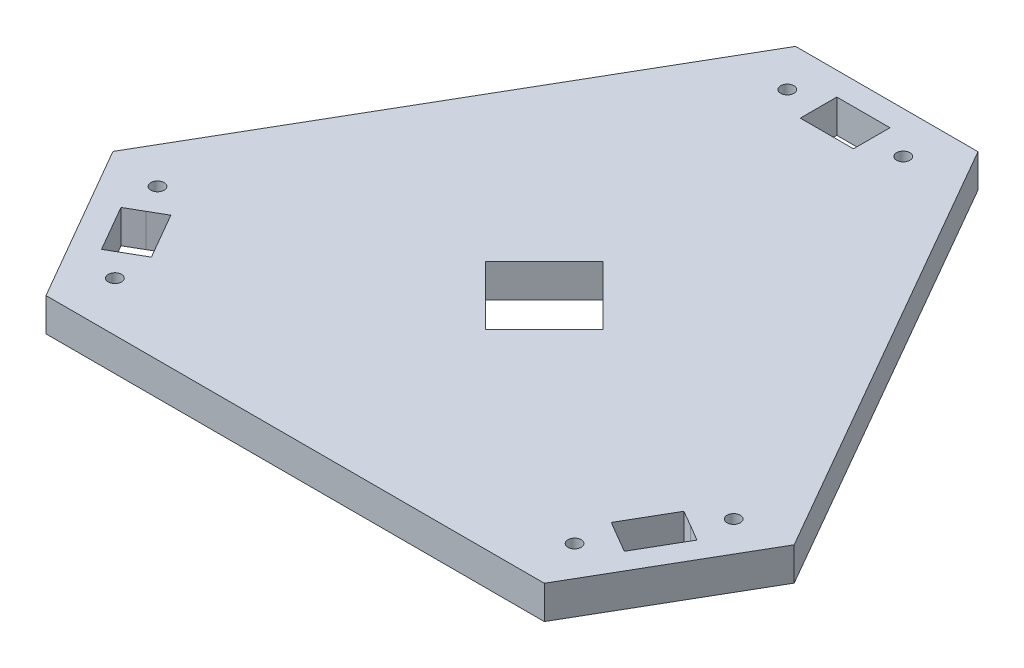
SolidWorks part; units mm, degrees
ref_plane "Ebene vorne" through (0, 0, 0) normal (0, 0, 1) x (1, 0, 0)
ref_plane "Ebene oben" through (0, 0, 0) normal (0, 1, 0) x (1, 0, 0)
ref_plane "Ebene rechts" through (0, 0, 0) normal (1, 0, 0) x (0, 0, -1)
sketch "Skizze1" plane through (0, 0, 0) normal (0, 1, 0) x (1, 0, 0)
  line L0 (-149.9886, 0) -> (150.0755, 0)
  line L1 (-54.2372, 355.613) -> (-204.9943, 95.3014)
  line L4 (205.2183, 95.3014) -> (55.5843, 355.613)
  line L5 (-54.2372, 355.613) -> (55.5843, 355.613)
  line L6 (205.2183, 95.3014) -> (150.0755, 0)
  line L7 (-149.9886, 0) -> (-204.9943, 95.3014)
extrude "Aufsatz-Linear austragen1" add sketch "Skizze1" along normal blind 20 contours L1 L7 L0 L6 L4 L5
sketch "Skizze2" plane through (0, 20, 0) normal (0, 1, 0) x (1, 0, 0)
  line L0 (205.2183, 95.3014) -> (150.0755, 0) construction
  circle A0 centre (173.5631, 90.5109) radius 4
  circle A1 centre (138.4531, 29.8315) radius 4
  dimension "D1" = 25
  dimension "D2" = 25
sketch "Skizze4" plane through (0, 20, 0) normal (0, 1, 0) x (1, 0, 0)
  line L0 (-54.2372, 355.613) -> (55.5843, 355.613) construction
  circle A0 centre (-34.2372, 330.613) radius 4
  circle A1 centre (35.5843, 330.613) radius 4
  dimension "D1" = 25
  dimension "D2" = 25
sketch "Skizze5" plane through (0, 20, 0) normal (0, 1, 0) x (1, 0, 0)
  line L0 (-149.9886, 0) -> (-204.9943, 95.3014) construction
  circle A0 centre (-173.3443, 90.4768) radius 4
  circle A1 centre (-138.334, 29.819) radius 4
  dimension "D1" = 25
  dimension "D2" = 25
sketch "Skizze7" plane through (0, 20, 0) normal (0, 1, 0) x (1, 0, 0)
  line L0 (-163.8464, 74.021) -> (-173.3734, 68.5223)
  line L3 (-147.8319, 46.2747) -> (-138.3049, 51.7735)
  line L4 (-138.3049, 51.7735) -> (-154.3013, 79.4884)
  line L5 (-154.3013, 79.4884) -> (-163.8464, 74.021)
  line L6 (-173.3734, 68.5223) -> (-157.377, 40.8074)
  line L7 (-157.377, 40.8074) -> (-147.8319, 46.2747)
  dimension "D3" = 11
  dimension "D6" = 32
extrude "Schnitt-Linear austragen7" cut sketch "Skizze7" against normal blind 20
sketch "Skizze8" plane through (0, 20, 0) normal (0, 1, 0) x (1, 0, 0)
  line L0 (164.0475, 74.0654) -> (154.5264, 79.5744)
  line L3 (147.9687, 46.277) -> (157.4898, 40.768)
  line L4 (154.5264, 79.5744) -> (138.5002, 51.8768)
  line L5 (138.5002, 51.8768) -> (147.9687, 46.277)
  line L6 (157.4898, 40.768) -> (173.516, 68.4656)
  line L7 (173.516, 68.4656) -> (164.0475, 74.0654)
  dimension "D4" = 11
  dimension "D5" = 32
extrude "Schnitt-Linear austragen8" cut sketch "Skizze8" against normal blind 20
sketch "Skizze11" plane through (0, 20, 0) normal (0, 1, 0) x (1, 0, 0)
  line L0 (-15.4157, 330.613) -> (-15.4157, 319.613)
  line L3 (-15.4157, 319.613) -> (16.5843, 319.613)
  line L4 (16.5843, 319.613) -> (16.5843, 341.613)
  line L5 (16.5843, 341.613) -> (-15.4157, 341.613)
  line L6 (-15.4157, 341.613) -> (-15.4157, 330.613)
  dimension "D1" = 32
  dimension "D4" = 22
extrude "Schnitt-Linear austragen9" cut sketch "Skizze11" against normal blind 20
extrude "Schnitt-Linear austragen10" cut sketch "Skizze2" against normal blind 10
extrude "Schnitt-Linear austragen11" cut sketch "Skizze4" against normal blind 10
extrude "Schnitt-Linear austragen12" cut sketch "Skizze5" against normal blind 10
sketch "Skizze16" plane through (0, 20, 0) normal (0, 1, 0) x (1, 0, 0)
  line L0 (-54.2372, 355.613) -> (55.5843, 355.613) construction
  line L10 (0, 114.7961) -> (-35.355, 150.1511)
  line L11 (0, 114.7961) -> (35.355, 150.1511)
  line L12 (-35.355, 150.1511) -> (0, 185.5061)
  line L13 (35.355, 150.1511) -> (0, 185.5061)
  point P0 (0.6736, 355.613)
  point P1 (0.6736, 355.613)
  point P4 (0, 185.5061)
  dimension "D1" = 49.9995
  dimension "D2" = 49.9995
extrude "Schnitt-Linear austragen15" cut sketch "Skizze16" against normal blind 20
